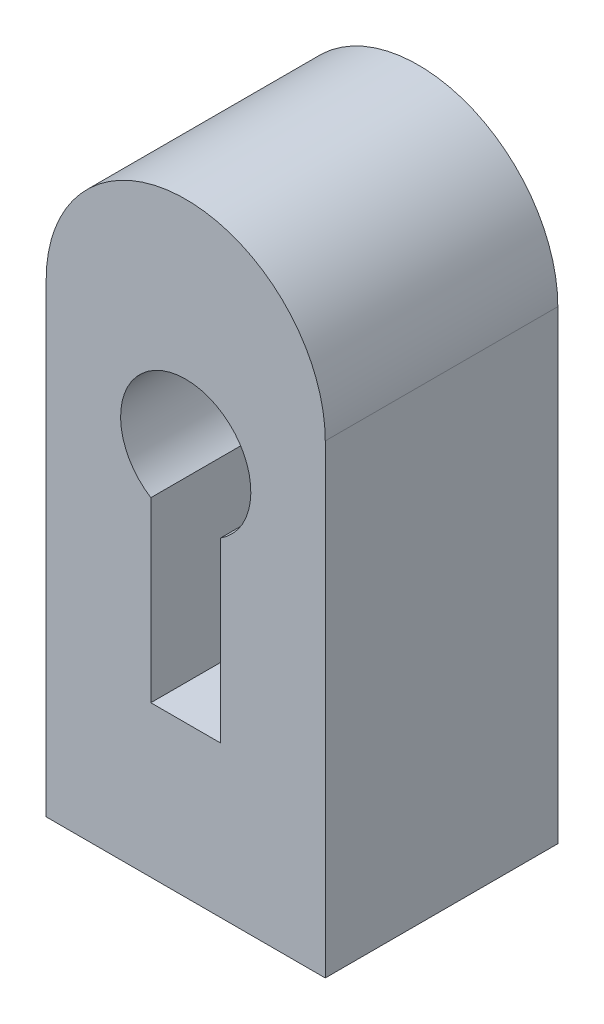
SolidWorks part; units mm, degrees
ref_plane "Front" through (0, 0, 0) normal (0, 0, 1) x (1, 0, 0)
ref_plane "Top" through (0, 0, 0) normal (0, 1, 0) x (1, 0, 0)
ref_plane "Right" through (0, 0, 0) normal (1, 0, 0) x (0, 0, -1)
sketch "Sketch1" plane through (0, 0, 0) normal (0, 0, 1) x (1, 0, 0)
  line L0 (-76.2, 127) -> (76.2, -127) construction
  line L2 (-76.2, 127) -> (-76.2, -127)
  line L3 (-76.2, -127) -> (76.2, -127)
  line L4 (76.2, 127) -> (76.2, -127)
  arc A0 (-76.2, 127) -> (76.2, 127) centre (0, 127) cw
  dimension "D1" = 254
  dimension "D2" = 152.4
extrude "Extrude1" add sketch "Sketch1" along normal mid plane 127
sketch "Sketch2" plane through (0, 0, 63.5) normal (0, 0, 1) x (1, 0, 0)
  line L0 (0, 0) -> (0, -93.8388) construction
  line L1 (19.05, 52.5232) -> (19.05, -44.45)
  line L2 (19.05, -44.45) -> (-19.05, -44.45)
  line L3 (-19.05, 52.5232) -> (-19.05, -44.45)
  arc A0 (19.05, 52.5232) -> (-19.05, 52.5232) centre (0, 82.55) ccw
  point P9 (0, -44.45)
  dimension "D2" = 35.56
  dimension "D1" = 82.55
  dimension "D3" = 38.1
  dimension "D4" = 44.45
extrude "Cut-Extrude1" cut sketch "Sketch2" against normal through all
